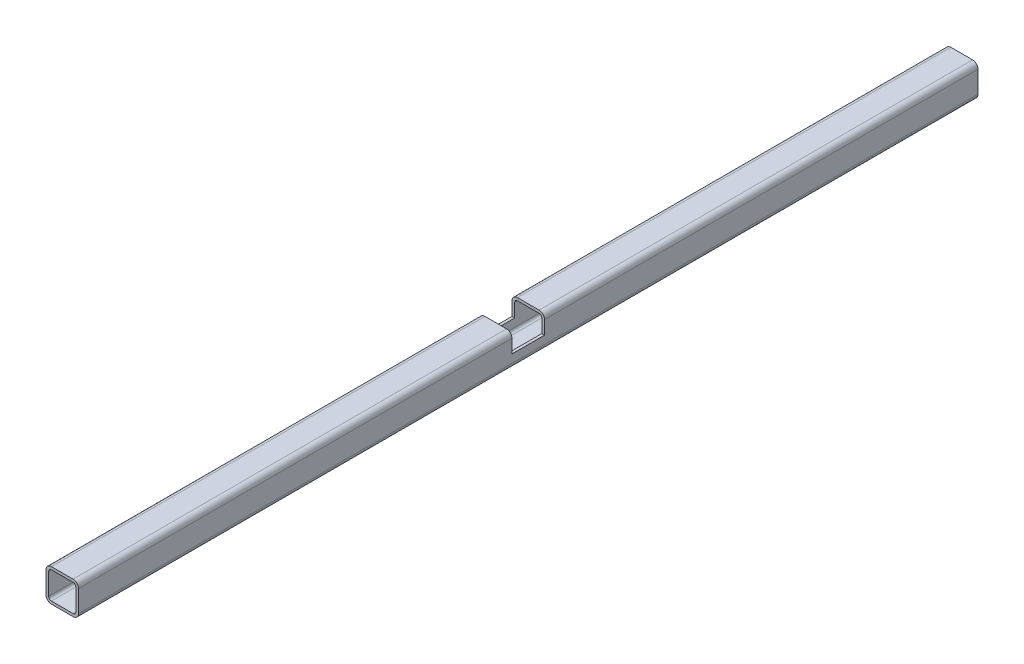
SolidWorks part; units mm, degrees
ref_plane "Plane1" through (0, 0, 0) normal (0, 0, 1) x (1, 0, 0)
ref_plane "Plane2" through (0, 0, 0) normal (0, 1, 0) x (1, 0, 0)
ref_plane "Plane3" through (0, 0, 0) normal (1, 0, 0) x (0, 0, -1)
sketch "Sketch1" plane through (0, 0, 0) normal (0, 0, 1) x (1, 0, 0)
  line L0 (-20, -25) -> (20, -25)
  line L1 (-25, -20) -> (-25, 20)
  line L2 (20, 25) -> (-20, 25)
  line L3 (25, 20) -> (25, -20)
  line L4 (-20, -30) -> (20, -30)
  line L5 (-30, -20) -> (-30, 20)
  line L6 (20, 30) -> (-20, 30)
  line L7 (30, 20) -> (30, -20)
  line L8 (-30, 0) -> (-25, 0) construction
  line L9 (-25, 0) -> (25, 0) construction
  line L10 (25, 0) -> (30, 0) construction
  line L12 (0, 30) -> (0, 25) construction
  line L13 (0, 25) -> (0, -25) construction
  line L14 (0, -25) -> (0, -30) construction
  arc A0 (30, 20) -> (20, 30) centre (20, 20) ccw
  arc A1 (20, -30) -> (30, -20) centre (20, -20) ccw
  arc A2 (-30, -20) -> (-20, -30) centre (-20, -20) ccw
  arc A3 (-20, 30) -> (-30, 20) centre (-20, 20) ccw
  arc A4 (-20, 25) -> (-25, 20) centre (-20, 20) ccw
  arc A5 (25, 20) -> (20, 25) centre (20, 20) ccw
  arc A6 (20, -25) -> (25, -20) centre (20, -20) ccw
  arc A7 (-25, -20) -> (-20, -25) centre (-20, -20) ccw
  point P2 (-30, 30)
  point P33 (-30, -30)
  point P34 (30, -30)
  point P36 (30, 30)
extrude "Extrusion1" add sketch "Sketch1" along normal blind 1660
sketch "Esquisse1" plane through (-30, 0, 0) normal (-1, 0, 0) x (0, 0, 1)
  line L0 (1660, 30) -> (0, 30) construction
  line L1 (800, -5) -> (860, -5)
  line L2 (800, -5) -> (800, 30)
  line L3 (800, 30) -> (860, 30)
  line L4 (860, -5) -> (860, 30)
  line L8 (0, 20) -> (0, -20) construction
  dimension "D1" = 60
  dimension "D2" = 35
  dimension "D4" = 800
extrude "Extrusion2" cut sketch "Esquisse1" against normal through all
